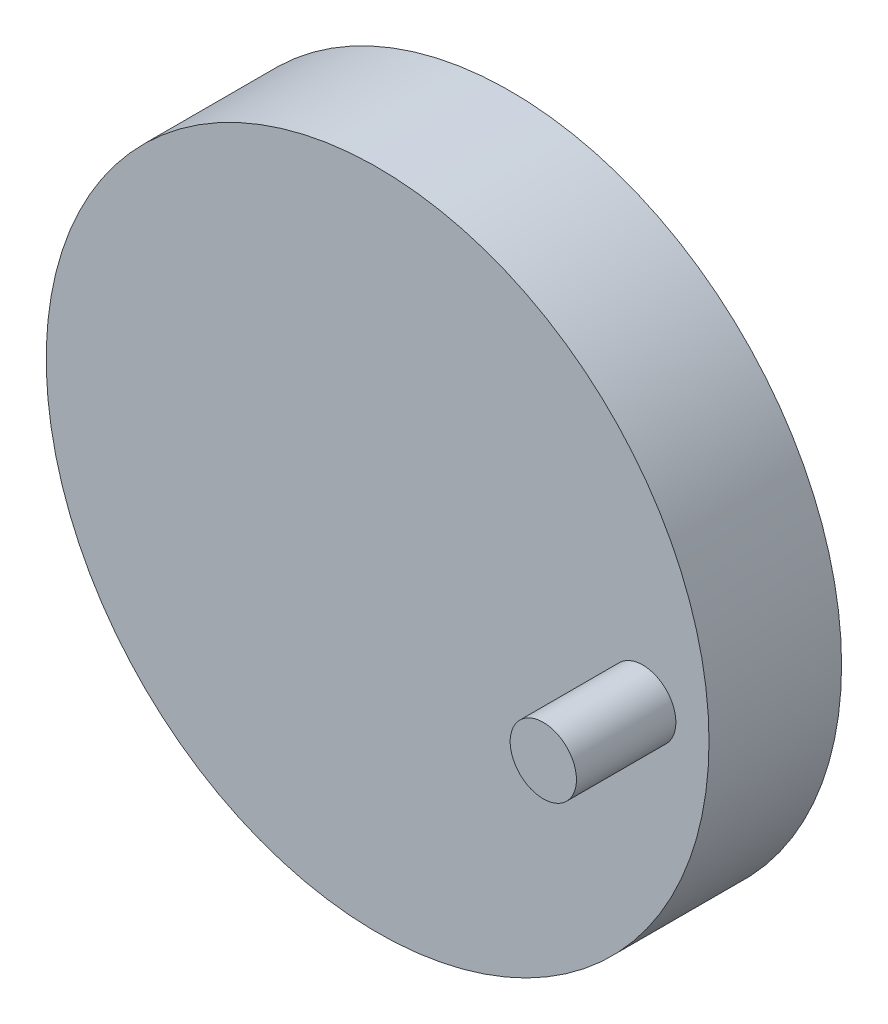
SolidWorks part; units mm, degrees
ref_plane "Front Plane" through (0, 0, 0) normal (0, 0, 1) x (1, 0, 0)
ref_plane "Top Plane" through (0, 0, 0) normal (0, 1, 0) x (1, 0, 0)
ref_plane "Right Plane" through (0, 0, 0) normal (1, 0, 0) x (0, 0, -1)
sketch "Sketch2" plane through (0, 0, 0) normal (0, 0, 1) x (1, 0, 0)
  circle A0 centre (0, 0) radius 50
  dimension "D1" = 100
extrude "Boss-Extrude1" add sketch "Sketch2" along normal blind 20 contours A0
sketch "Sketch3" plane through (0, 0, 0) normal (0, 0, 1) x (1, 0, 0)
  circle A0 centre (0, 0) radius 10
  dimension "D1" = 20
extrude "Boss-Extrude2" add sketch "Sketch3" against normal blind 20
sketch "Sketch4" plane through (0, 0, 0) normal (0, 0, 1) x (1, 0, 0)
  circle A0 centre (40, 0) radius 5
  dimension "D1" = 10
  dimension "D2" = 40
extrude "Boss-Extrude3" add sketch "Sketch4" along normal blind 35
